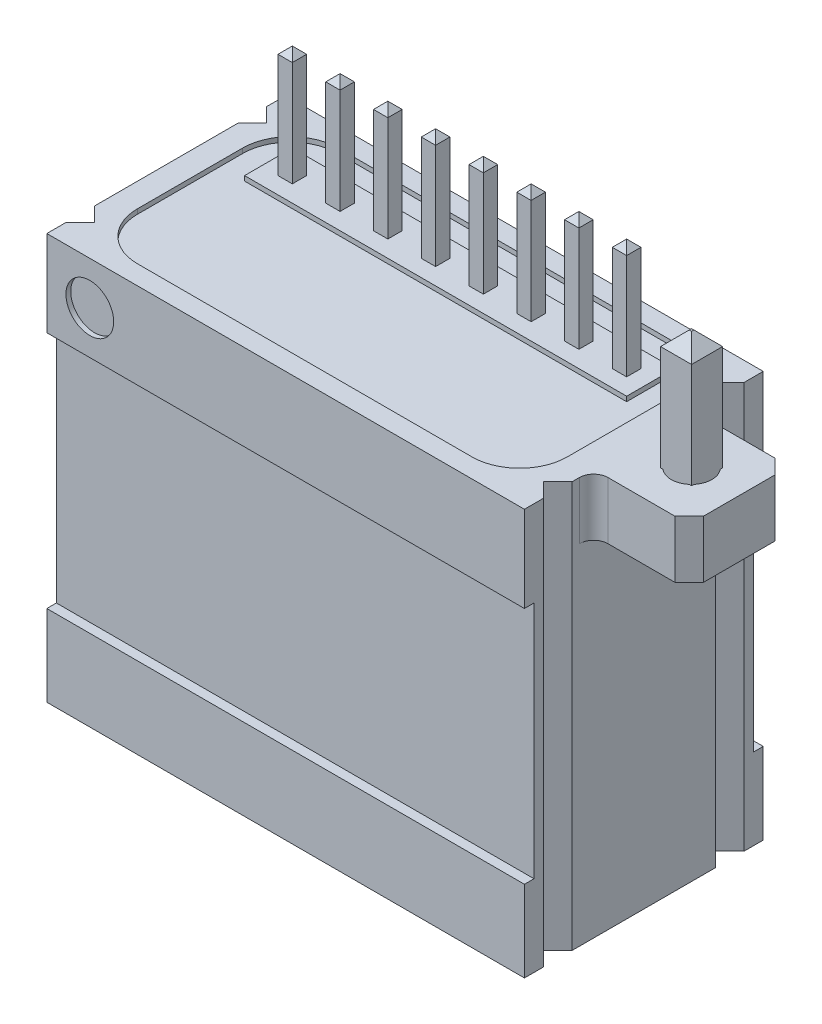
SolidWorks part; units mm, degrees
ref_plane "Front Plane" through (0, 0, 0) normal (0, 0, 1) x (1, 0, 0)
ref_plane "Top Plane" through (0, 0, 0) normal (0, 1, 0) x (1, 0, 0)
ref_plane "Right Plane" through (0, 0, 0) normal (1, 0, 0) x (0, 0, -1)
sketch "Sketch11" plane through (0, 0, 0) normal (0, 1, 0) x (1, 0, 0)
  line L1 (0, 0) -> (10, 0)
  line L2 (0, 0) -> (0, 5)
  line L3 (0, 5) -> (10, 5)
  line L4 (10, 0) -> (10, 5)
  dimension "D1" = 5
  dimension "D2" = 10
extrude "Boss-Extrude2" add sketch "Sketch11" along normal blind 8.5
sketch "Sketch12" plane through (10, 0, 0) normal (1, 0, 0) x (0, 0, -1)
  line L0 (0, 8.5) -> (0, 6.7)
  line L1 (0, 8.5) -> (0, 0) construction
  line L2 (0, 6.7) -> (0.2, 6.7)
  line L3 (0.2, 6.7) -> (0.2, 1.7)
  line L4 (0, 8.5) -> (5, 8.5) construction
  line L5 (4.8, 1.7) -> (5, 1.7)
  line L6 (2.5, 8.5) -> (2.5, 0) construction
  line L7 (0, 0) -> (5, 0) construction
  line L8 (5, 8.5) -> (0, 8.5)
  line L9 (5, 0) -> (0, 0)
  line L10 (0, 0) -> (0, 1.7)
  line L11 (5, 0) -> (5, 1.7)
  line L12 (0.2, 1.7) -> (0, 1.7)
  line L13 (4.8, 6.7) -> (4.8, 1.7)
  line L14 (5, 6.7) -> (4.8, 6.7)
  line L15 (5, 8.5) -> (5, 6.7)
  dimension "D1" = 1.8
  dimension "D2" = 0.2
  dimension "D3" = 5
  dimension "D4" = 90
  dimension "D5" = 1.7
extrude "Cut-Extrude1" cut sketch "Sketch12" against normal blind 11 flip side to cut
sketch "Sketch13" plane through (0, 8.5, 0) normal (0, -1, 0) x (1, 0, 0)
  line L0 (0, -2.5) -> (10, -2.5) construction
  line L1 (0, -5) -> (0, 0) construction
  line L2 (10, 0) -> (10, -5) construction
  line L3 (5, 0) -> (5, -5) construction
  line L4 (0, 0) -> (10, 0) construction
  line L5 (10, -5) -> (0, -5) construction
  line L6 (1, -0.6) -> (9, -0.6)
  line L7 (9.2, -0.8) -> (9.2, -4.2)
  line L8 (0.8, -0.8) -> (0.8, -4.2)
  line L11 (0.6467, -1.5741) -> (0.6467, -3.5741) construction
  line L12 (9.393, -1.5) -> (0.607, -1.5) construction
  line L13 (9.393, -1.5) -> (9.393, -3.5) construction
  line L14 (9.393, -3.5) -> (0.607, -3.5) construction
  line L15 (0.607, -1.5) -> (0.607, -3.5) construction
  line L16 (0.6467, -1.5741) -> (9.3467, -1.5741) construction
  line L17 (0.6467, -3.5741) -> (9.3467, -3.5741) construction
  line L18 (9.3467, -1.5741) -> (9.3467, -3.5741) construction
  line L19 (1, -4.4) -> (9, -4.4)
  arc A0 (0.8, -4.2) -> (1, -4.4) centre (1, -4.2) ccw
  arc A1 (0.8, -0.8) -> (1, -0.6) centre (1, -0.8) cw
  arc A2 (9, -4.4) -> (9.2, -4.2) centre (9, -4.2) ccw
  arc A3 (9.2, -0.8) -> (9, -0.6) centre (9, -0.8) ccw
  point P24 (0.5, -2.5)
  point P34 (9.5, -2.5)
  dimension "D3" = 4.2
  dimension "D4" = 0.2
  dimension "D5" = 1.9
  dimension "D6" = 0.2
  dimension "D1" = 1.9
  dimension "D2" = 4.2
  dimension "D8" = 2
  dimension "D9" = 8.7861
  dimension "D10" = 8.7
  dimension "D11" = 2
  dimension "D13" = 0.9259
extrude "Cut-Extrude2" cut sketch "Sketch13" along normal blind 8.3
sketch "Sketch18" plane through (0, 8.5, 0) normal (0, 1, 0) x (1, 0, 0)
  line L0 (5, 5) -> (5, 0) construction
  line L1 (1.5, 3.8556) -> (4.2, 3.8556)
  line L2 (1.5, 3.8556) -> (1.5, 4.4)
  line L3 (1.7, 4.6) -> (4, 4.6)
  line L4 (4.2, 3.8556) -> (4.2, 4.4)
  line L5 (10, 5) -> (0, 5) construction
  line L6 (0, 0) -> (10, 0) construction
  line L7 (0, 2.5) -> (10, 2.5) construction
  line L8 (0, 5) -> (0, 0) construction
  line L9 (10, 0) -> (10, 5) construction
  arc A0 (4, 4.6) -> (4.2, 4.4) centre (4, 4.4) cw
  arc A1 (1.5, 4.4) -> (1.7, 4.6) centre (1.7, 4.4) cw
  point P18 (4.2, 4.6)
  point P21 (1.5, 4.6)
  dimension "D4" = 0.2
  dimension "D1" = 0.8
  dimension "D2" = 2.7
  dimension "D3" = 2.1
extrude "Cut-Extrude6" cut sketch "Sketch18" against normal blind 6
sketch "Sketch14" plane through (0, 8.5, 0) normal (0, -1, 0) x (1, 0, 0)
  line L0 (5, -5) -> (5, 0) construction
  line L1 (10, -5) -> (0, -5) construction
  line L2 (0, 0) -> (10, 0) construction
  line L3 (8.5, -4.6) -> (1.5, -4.6)
  line L4 (10, -2.5) -> (0, -2.5) construction
  line L5 (10, 0) -> (10, -5) construction
  line L6 (0, -5) -> (0, 0) construction
  line L7 (8.5, -0.4) -> (1.5, -0.4)
  line L16 (9.5, -3.6) -> (9.5, -1.4)
  line L19 (0.5, -1.4) -> (0.5, -3.6)
  arc A0 (9.5, -3.6) -> (8.5, -4.6) centre (8.5, -3.6) cw
  arc A1 (1.5, -0.4) -> (0.5, -1.4) centre (1.5, -1.4) ccw
  arc A2 (9.5, -1.4) -> (8.5, -0.4) centre (8.5, -1.4) ccw
  arc A3 (1.5, -4.6) -> (0.5, -3.6) centre (1.5, -3.6) cw
  point P0 (9.5, -2.5)
  point P24 (0.5, -2.5)
  dimension "D2" = 1
  dimension "D7" = 1
  dimension "D3" = 4.5
  dimension "D4" = 4.5
  dimension "D8" = 2.1
extrude "Cut-Extrude3" cut sketch "Sketch14" along normal blind 1.5
sketch "Sketch15" plane through (0, 8.5, 0) normal (0, 1, 0) x (1, 0, 0)
  line L0 (0.5, 1.4) -> (0.5, 3.6) construction
  line L1 (0.6, 3.6) -> (9.4, 3.6)
  line L2 (0.5, 3.5) -> (0.5, 1.5)
  line L3 (0.6, 1.4) -> (9.4, 1.4)
  line L4 (9.5, 3.5) -> (9.5, 1.5)
  line L5 (9.5, 3.6) -> (9.5, 1.4) construction
  line L6 (0, 2.5) -> (10, 2.5) construction
  line L7 (0, 5) -> (0, 0) construction
  line L8 (10, 0) -> (10, 5) construction
  arc A0 (9.4, 1.4) -> (9.5, 1.5) centre (9.4, 1.5) ccw
  arc A1 (9.4, 3.6) -> (9.5, 3.5) centre (9.4, 3.5) cw
  arc A2 (0.5, 1.5) -> (0.6, 1.4) centre (0.6, 1.5) ccw
  arc A3 (0.6, 3.6) -> (0.5, 3.5) centre (0.6, 3.5) ccw
  point P16 (9.5, 1.4)
  point P23 (0.5, 3.6)
  dimension "D3" = 0.1
  dimension "D1" = 1.1
  dimension "D2" = 1.1
extrude "Cut-Extrude4" cut sketch "Sketch15" against normal blind 8.3
sketch "Sketch16" plane through (0, 0, 0) normal (-1, 0, 0) x (0, 0, 1)
  line L0 (-4.8395, 0.9395) -> (-4.1, 0.2)
  line L1 (-3.6, 0.2) -> (-4.2, 0.2) construction
  line L2 (-0.9, 0.2) -> (-0.0406, 1.0594)
  line L3 (-0.8, 0.2) -> (-1.4, 0.2) construction
  line L4 (-5, 0) -> (0, 0) construction
  line L5 (-4.1, 0.2) -> (-4.8395, 0.2)
  line L6 (-4.8395, 0.2) -> (-4.8395, 0.9395)
  line L9 (-0.0406, 1.0594) -> (-0.0406, 0.2)
  line L10 (-0.0406, 0.2) -> (-0.9, 0.2)
  line L11 (-5, 1.7) -> (-5, 0) construction
  line L12 (0, 1.7) -> (0, 0) construction
  dimension "D1" = 45
  dimension "D2" = 45
  dimension "D3" = 0.9
  dimension "D4" = 0.9
extrude "Boss-Extrude3" add sketch "Sketch16" against normal blind 9.5
sketch "Sketch17" plane through (0, 8.5, 0) normal (0, 1, 0) x (1, 0, 0)
  line L0 (0, 2.5) -> (10, 2.5) construction
  line L1 (0, 5) -> (0, 0) construction
  line L2 (10, 0) -> (10, 5) construction
  line L3 (5, 5) -> (5, 0) construction
  line L4 (10, 5) -> (0, 5) construction
  line L5 (0, 0) -> (10, 0) construction
  line L6 (-0.2423, 4.8423) -> (0.3, 4.3)
  line L7 (0.3, 4.3) -> (-0.2423, 3.7577)
  line L8 (-0.2423, 3.7577) -> (-0.2423, 4.8423)
  line L9 (10.2423, 3.7577) -> (10.2423, 4.8423)
  line L10 (9.7, 4.3) -> (10.2423, 3.7577)
  line L11 (10.2423, 4.8423) -> (9.7, 4.3)
  line L12 (10.2423, 0.1577) -> (9.7, 0.7)
  line L13 (9.7, 0.7) -> (10.2423, 1.2423)
  line L14 (10.2423, 1.2423) -> (10.2423, 0.1577)
  line L15 (-0.2423, 1.2423) -> (-0.2423, 0.1577)
  line L16 (0.3, 0.7) -> (-0.2423, 1.2423)
  line L17 (-0.2423, 0.1577) -> (0.3, 0.7)
  dimension "D1" = 90
  dimension "D2" = 135
  dimension "D3" = 0.3
  dimension "D4" = 1.8
extrude "Cut-Extrude5" cut sketch "Sketch17" against normal blind 9.5
sketch "Sketch19" plane through (0, 0, 0) normal (0, 0, 1) x (1, 0, 0)
  line L0 (0, 8.5) -> (10, 8.5) construction
  line L1 (0, 8.5) -> (0, 6.7) construction
  circle A0 centre (0.9, 7.6) radius 0.5
  dimension "D2" = 0.9
  dimension "D3" = 1
  dimension "D1" = 0.9
extrude "Cut-Extrude7" cut sketch "Sketch19" against normal blind 0.1
sketch "Sketch20" plane through (0, 0, -5) normal (0, 0, -1) x (-1, 0, 0)
  line L0 (-10, 8.5) -> (0, 8.5) construction
  line L1 (0, 8.5) -> (0, 6.7) construction
  circle A0 centre (-0.9, 7.6) radius 0.5
  dimension "D2" = 0.9
  dimension "D3" = 1
  dimension "D1" = 0.9
extrude "Cut-Extrude8" cut sketch "Sketch20" against normal blind 0.1
sketch "Sketch21" plane through (0, 8.5, 0) normal (0, 1, 0) x (1, 0, 0)
  line L0 (10, 1) -> (10, 4) construction
  line L1 (10.3, 3.55) -> (11.7, 3.55)
  line L2 (10, 1.15) -> (10, 1)
  line L3 (10.3, 1.45) -> (11.7, 1.45)
  line L4 (12, 3.25) -> (12, 1.75)
  line L5 (9.5554, 3.9764) -> (10, 3.9764)
  line L6 (9.5554, 3.9764) -> (9.5554, 1)
  line L7 (9.5554, 1) -> (10, 1)
  line L8 (10, 3.9764) -> (10, 3.85)
  line L9 (10, 2.5) -> (0, 2.5) construction
  line L10 (11.7, 3.55) -> (12, 3.25)
  line L11 (11.7, 1.45) -> (12, 1.75)
  circle A0 centre (11, 2.5) radius 0.425
  arc A1 (10.3, 1.45) -> (10, 1.15) centre (10.3, 1.15) ccw
  arc A2 (10.3, 3.55) -> (10, 3.85) centre (10.3, 3.85) cw
  point P1 (12, 1.45)
  point P3 (12, 3.55)
  point P20 (10, 1.45)
  dimension "D4" = 0.85
  dimension "D7" = 0.3
  dimension "D1" = 1.05
  dimension "D2" = 1.05
  dimension "D3" = 2
  dimension "D5" = 1
  dimension "D6" = 1.05
  dimension "D9" = 0.3
  dimension "D10" = 0.3
extrude "Boss-Extrude4" add sketch "Sketch21" against normal blind 1.2
sketch "Sketch22" plane through (0, 0.2, 0) normal (0, 1, 0) x (1, 0, 0)
  line L1 (0.3863, 4.706) -> (9.6052, 4.706)
  line L2 (0.3863, 4.706) -> (0.3863, 0.2601)
  line L3 (0.3863, 0.2601) -> (9.6052, 0.2601)
  line L4 (9.6052, 4.706) -> (9.6052, 0.2601)
extrude "Boss-Extrude5" add sketch "Sketch22" along normal blind 8.2
sketch "Sketch23" plane through (0, 7.3, 0) normal (0, -1, 0) x (1, 0, 0)
  line L0 (7.37, -3.77) -> (7.67, -3.77)
  line L1 (10.6749, -2.1751) -> (10.6751, -2.8251)
  line L2 (10.6751, -2.8251) -> (11.3251, -2.8249)
  line L3 (11.3251, -2.8249) -> (11.3249, -2.1749)
  line L4 (11.3249, -2.1749) -> (10.6749, -2.1751)
  line L5 (8.37, -3.77) -> (8.67, -3.77)
  line L6 (8.67, -3.77) -> (8.67, -3.47)
  line L7 (8.67, -3.47) -> (8.37, -3.47)
  line L8 (8.37, -3.47) -> (8.37, -3.77)
  line L9 (7.67, -3.77) -> (7.67, -3.47)
  line L10 (7.67, -3.47) -> (7.37, -3.47)
  line L11 (7.37, -3.47) -> (7.37, -3.77)
  line L12 (6.37, -3.77) -> (6.67, -3.77)
  line L13 (6.67, -3.77) -> (6.67, -3.47)
  line L14 (6.67, -3.47) -> (6.37, -3.47)
  line L15 (6.37, -3.47) -> (6.37, -3.77)
  line L16 (5.37, -3.77) -> (5.67, -3.77)
  line L17 (5.67, -3.77) -> (5.67, -3.47)
  line L18 (5.67, -3.47) -> (5.37, -3.47)
  line L19 (5.37, -3.47) -> (5.37, -3.77)
  line L20 (4.37, -3.77) -> (4.67, -3.77)
  line L21 (4.67, -3.77) -> (4.67, -3.47)
  line L22 (4.67, -3.47) -> (4.37, -3.47)
  line L23 (4.37, -3.47) -> (4.37, -3.77)
  line L24 (3.37, -3.77) -> (3.67, -3.77)
  line L25 (3.67, -3.77) -> (3.67, -3.47)
  line L26 (3.67, -3.47) -> (3.37, -3.47)
  line L27 (3.37, -3.47) -> (3.37, -3.77)
  line L28 (2.37, -3.77) -> (2.67, -3.77)
  line L29 (2.67, -3.77) -> (2.67, -3.47)
  line L30 (2.67, -3.47) -> (2.37, -3.47)
  line L31 (2.37, -3.47) -> (2.37, -3.77)
  line L32 (1.37, -3.77) -> (1.67, -3.77)
  line L33 (1.67, -3.77) -> (1.67, -3.47)
  line L34 (1.67, -3.47) -> (1.37, -3.47)
  line L35 (1.37, -3.47) -> (1.37, -3.77)
  circle A0 centre (11, -2.5) radius 0.325 construction
  circle A1 centre (8.52, -3.62) radius 0.15 construction
  circle A2 centre (7.52, -3.62) radius 0.15 construction
  circle A3 centre (6.52, -3.62) radius 0.15 construction
  circle A4 centre (5.52, -3.62) radius 0.15 construction
  circle A5 centre (4.52, -3.62) radius 0.15 construction
  circle A6 centre (3.52, -3.62) radius 0.15 construction
  circle A7 centre (2.52, -3.62) radius 0.15 construction
  circle A8 centre (1.52, -3.62) radius 0.15 construction
  dimension "D3" = 2.48
  dimension "D4" = 1.12
  dimension "D1" = 0.65
  dimension "D2" = 0.3
  dimension "D5" = 8
extrude "Boss-Extrude6" add sketch "Sketch23" against normal blind 3.4
sketch "Sketch24" plane through (0, 10.7, 0) normal (0, 1, 0) x (1, 0, 0)
  line L8 (10.6749, 2.1751) -> (11.3249, 2.1749)
  line L9 (11.3249, 2.1749) -> (11.3251, 2.8249)
  line L10 (11.3251, 2.8249) -> (10.6751, 2.8251)
  line L11 (10.6751, 2.8251) -> (10.6749, 2.1751)
  line L12 (10.6749, 2.1751) -> (11.3249, 2.1749)
  line L13 (11.3249, 2.1749) -> (11.3251, 2.8249)
  line L14 (11.3251, 2.8249) -> (10.6751, 2.8251)
  line L15 (10.6751, 2.8251) -> (10.6749, 2.1751)
  line L20 (8.37, 3.77) -> (8.37, 3.47)
  line L21 (8.37, 3.47) -> (8.67, 3.47)
  line L22 (8.67, 3.47) -> (8.67, 3.77)
  line L23 (8.67, 3.77) -> (8.37, 3.77)
  line L24 (8.37, 3.77) -> (8.37, 3.47)
  line L25 (8.37, 3.47) -> (8.67, 3.47)
  line L26 (8.67, 3.47) -> (8.67, 3.77)
  line L27 (8.67, 3.77) -> (8.37, 3.77)
  line L32 (7.37, 3.77) -> (7.37, 3.47)
  line L33 (7.37, 3.47) -> (7.67, 3.47)
  line L34 (7.67, 3.47) -> (7.67, 3.77)
  line L35 (7.67, 3.77) -> (7.37, 3.77)
  line L36 (7.37, 3.77) -> (7.37, 3.47)
  line L37 (7.37, 3.47) -> (7.67, 3.47)
  line L38 (7.67, 3.47) -> (7.67, 3.77)
  line L39 (7.67, 3.77) -> (7.37, 3.77)
  line L44 (6.37, 3.77) -> (6.37, 3.47)
  line L45 (6.37, 3.47) -> (6.67, 3.47)
  line L46 (6.67, 3.47) -> (6.67, 3.77)
  line L47 (6.67, 3.77) -> (6.37, 3.77)
  line L48 (6.37, 3.77) -> (6.37, 3.47)
  line L49 (6.37, 3.47) -> (6.67, 3.47)
  line L50 (6.67, 3.47) -> (6.67, 3.77)
  line L51 (6.67, 3.77) -> (6.37, 3.77)
  line L56 (5.37, 3.77) -> (5.37, 3.47)
  line L57 (5.37, 3.47) -> (5.67, 3.47)
  line L58 (5.67, 3.47) -> (5.67, 3.77)
  line L59 (5.67, 3.77) -> (5.37, 3.77)
  line L60 (5.37, 3.77) -> (5.37, 3.47)
  line L61 (5.37, 3.47) -> (5.67, 3.47)
  line L62 (5.67, 3.47) -> (5.67, 3.77)
  line L63 (5.67, 3.77) -> (5.37, 3.77)
  line L68 (4.37, 3.77) -> (4.37, 3.47)
  line L69 (4.37, 3.47) -> (4.67, 3.47)
  line L70 (4.67, 3.47) -> (4.67, 3.77)
  line L71 (4.67, 3.77) -> (4.37, 3.77)
  line L72 (4.37, 3.77) -> (4.37, 3.47)
  line L73 (4.37, 3.47) -> (4.67, 3.47)
  line L74 (4.67, 3.47) -> (4.67, 3.77)
  line L75 (4.67, 3.77) -> (4.37, 3.77)
  line L80 (3.37, 3.77) -> (3.37, 3.47)
  line L81 (3.37, 3.47) -> (3.67, 3.47)
  line L82 (3.67, 3.47) -> (3.67, 3.77)
  line L83 (3.67, 3.77) -> (3.37, 3.77)
  line L84 (3.37, 3.77) -> (3.37, 3.47)
  line L85 (3.37, 3.47) -> (3.67, 3.47)
  line L86 (3.67, 3.47) -> (3.67, 3.77)
  line L87 (3.67, 3.77) -> (3.37, 3.77)
  line L92 (2.37, 3.77) -> (2.37, 3.47)
  line L93 (2.37, 3.47) -> (2.67, 3.47)
  line L94 (2.67, 3.47) -> (2.67, 3.77)
  line L95 (2.67, 3.77) -> (2.37, 3.77)
  line L96 (2.37, 3.77) -> (2.37, 3.47)
  line L97 (2.37, 3.47) -> (2.67, 3.47)
  line L98 (2.67, 3.47) -> (2.67, 3.77)
  line L99 (2.67, 3.77) -> (2.37, 3.77)
  line L104 (1.37, 3.77) -> (1.37, 3.47)
  line L105 (1.37, 3.47) -> (1.67, 3.47)
  line L106 (1.67, 3.47) -> (1.67, 3.77)
  line L107 (1.67, 3.77) -> (1.37, 3.77)
  line L108 (1.37, 3.77) -> (1.37, 3.47)
  line L109 (1.37, 3.47) -> (1.67, 3.47)
  line L110 (1.67, 3.47) -> (1.67, 3.77)
  line L111 (1.67, 3.77) -> (1.37, 3.77)
  dimension "D1" = 0
  dimension "D2" = 0
  dimension "D3" = 0
  dimension "D4" = 0
  dimension "D5" = 0
  dimension "D6" = 0
  dimension "D7" = 0
  dimension "D8" = 0
  dimension "D9" = 0
extrude "Boss-Extrude7" add sketch "Sketch24" along normal blind 0.3 draft 45
sketch "Sketch26" plane through (0, 8.4, 0) normal (0, 1, 0) x (1, 0, 0)
  line L0 (9.02, 4.12) -> (9.02, 3.12)
  line L1 (1.02, 4.12) -> (9.02, 4.12)
  line L2 (1.02, 4.12) -> (1.02, 3.12)
  line L3 (1.02, 3.12) -> (9.02, 3.12)
  dimension "D1" = 1
  dimension "D2" = 8
  dimension "D3" = 0.5
  dimension "D4" = 0.5
extrude "Boss-Extrude8" add sketch "Sketch26" along normal blind 0.1
sketch "Sketch27" plane through (0, 7.3, 0) normal (0, -1, 0) x (1, 0, 0)
  line L2 (10.6749, -2.2262) -> (10.6751, -2.7739)
  line L3 (10.6749, -2.1751) -> (10.6751, -2.8251)
  line L5 (11.2738, -2.1749) -> (10.7261, -2.1751)
  line L6 (11.3249, -2.1749) -> (10.6749, -2.1751)
  line L8 (11.3251, -2.7738) -> (11.3249, -2.2261)
  line L9 (11.3251, -2.8249) -> (11.3249, -2.1749)
  line L11 (10.7262, -2.8251) -> (11.2739, -2.8249)
  line L12 (10.6751, -2.8251) -> (11.3251, -2.8249)
  dimension "D1" = 0
  dimension "D2" = 0
  dimension "D3" = 0
  dimension "D4" = 0
extrude "Boss-Extrude9" add sketch "Sketch27" along normal blind 0.1
